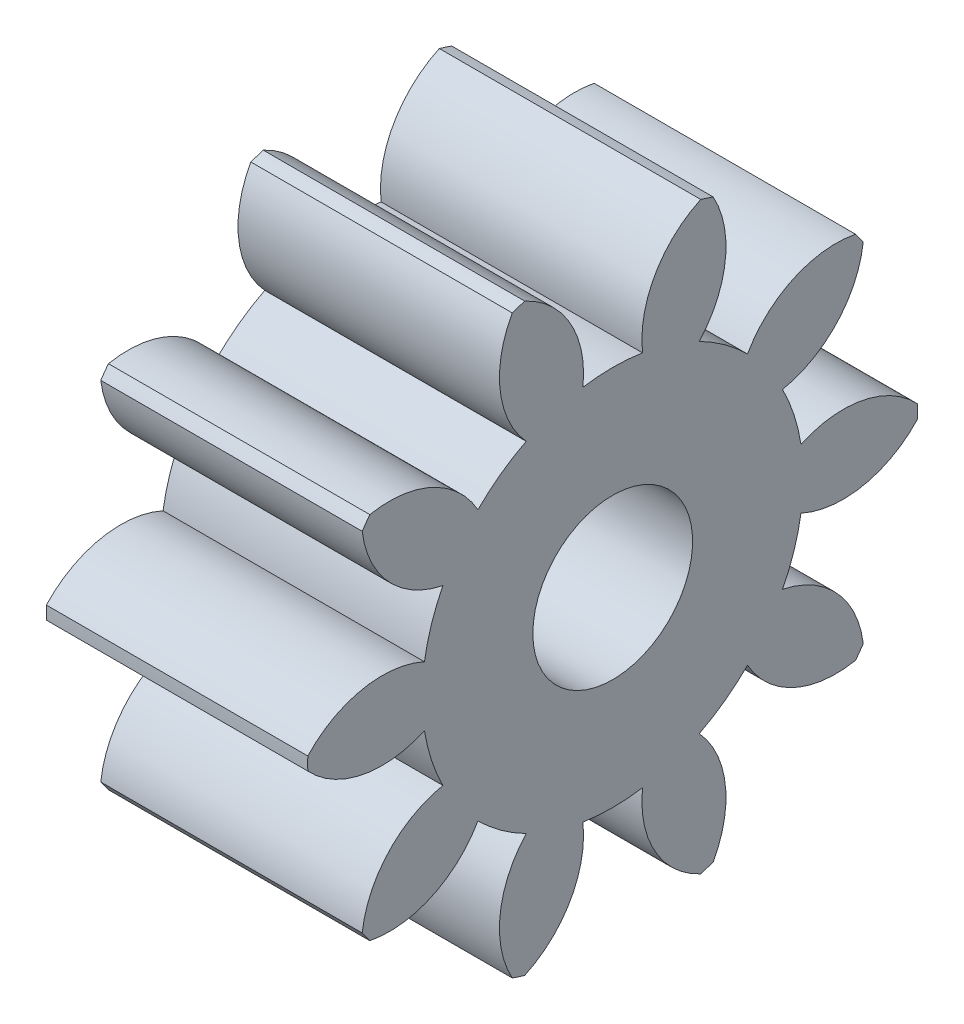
SolidWorks part; units mm, degrees
ref_plane "Plane1" through (0, 0, 0) normal (0, 0, 1) x (1, 0, 0)
ref_plane "Plane2" through (0, 0, 0) normal (0, 1, 0) x (1, 0, 0)
ref_plane "Plane3" through (0, 0, 0) normal (1, 0, 0) x (0, 0, -1)
other "Configuration Table"
sketch "HoldingSke" plane through (0, 0, 0) normal (0, 1, 0) x (1, 0, 0)
  line L0 (0, 0) -> (0.2814, -0.0496)
  line L1 (-15, 0) -> (100, 0) construction
  line L2 (0, 0) -> (-2.1039, 2.3779)
  line L3 (0, 0) -> (-11.863, 4.5341)
  line L4 (0, 0) -> (8.5048, 1.4996)
  line L5 (0, 0) -> (-46.8476, -17.4728)
  line L6 (0, 0) -> (-14.9213, -10.0675)
  line L7 (-2.1039, 2.3779) -> (8.6586, 51.2059)
  line L8 (-76.2, 54.61) -> (-74.4, 54.61)
  line L9 (-71.009, 38.7566) -> (-53.1078, 45.2721)
  line L10 (-76.2, 71.12) -> (104.1128, 71.12)
  line L11 (0, 0) -> (-18, 0)
  line L12 (-76.2, 101.6) -> (-76.083, 101.6)
  line L13 (24.9733, 27.94) -> (52.9518, 28.4284)
  line L14 (24.9733, 27.94) -> (24.9743, 27.94)
  line L15 (24.9733, 27.94) -> (100.4006, 29.5858)
  line L16 (-63.627, -3.5) -> (-12.827, -3.5)
  circle A0 centre (0, 0) radius 5.5
  circle A1 centre (0, 0) radius 13.124
  circle A2 centre (0, 0) radius 37.5
  circle A3 centre (0, 0) radius 5.5
sketch "BasProSke" plane through (0, 0, 0) normal (0, 1, 0) x (1, 0, 0)
  line L0 (-10, 0) -> (60, 0) construction
  line L1 (0, 0) -> (0, 21)
  line L2 (0, 0) -> (18, 0)
  line L3 (18, 0) -> (18, 21)
  line L4 (18, 21) -> (0, 21)
revolve "Base-Revolve" add sketch "BasProSke" angle 360 about L0
sketch "TooCutSke" plane through (0, 0, 0) normal (1, 0, 0) x (0, 0, -1)
  line L1 (0, 0) -> (0, 107) construction
  line L2 (0, 0) -> (-2.942, 17.2509) construction
  line L3 (0, 0) -> (-10.7017, 32.9365) construction
  line L4 (-2.942, 17.2509) -> (-5.3509, 16.4682) construction
  arc A0 (2.0535, 12.9624) -> (-2.0535, 12.9624) centre (0, 0) ccw
  arc A1 (6.0946, 20.1227) -> (-6.0946, 20.1227) centre (0, 0) ccw
  circle A2 centre (0, 0) radius 17.5 construction
  circle A3 centre (0, 0) radius 16.4446 construction
  arc A4 (-2.0535, 12.9624) -> (-6.0946, 20.1227) centre (-9.0081, 13.7579) ccw
  arc A5 (6.0946, 20.1227) -> (2.0535, 12.9624) centre (9.0081, 13.7579) ccw
extrude "ToothCut" cut sketch "TooCutSke" along normal through all
fillet "Breaks" [suppressed] radius 0.07
fillet "RootFillets" [suppressed] radius 0.876
pattern_circular "TeethCuts" count 10 every 36 about axis through (-10, 0, 0) along (1, 0, 0) of "ToothCut", "RootFillets", "Breaks"
sketch "HubNeaOneSke" plane through (0, 0, 0) normal (-1, 0, 0) x (0, 0, 1)
  circle A0 centre (0, 0) radius 13.124
extrude "HubNearOne" [suppressed] add sketch "HubNeaOneSke" along normal blind 32.0001
sketch "HubNeaBotSke" plane through (0, 0, 0) normal (-1, 0, 0) x (0, 0, 1)
  circle A0 centre (0, 0) radius 13.124
extrude "HubNearBoth" [suppressed] add sketch "HubNeaBotSke" along normal blind 16
ref_plane "FarPln" through (18, 0, 0) normal (1, 0, 0) x (0, 0, -1)
sketch "HubFarSke" plane through (18, 0, 0) normal (1, 0, 0) x (0, 0, -1)
  circle A0 centre (0, 0) radius 13.124
extrude "HubFar" [suppressed] add sketch "HubFarSke" along normal blind 16
sketch "BorSke" plane through (0, 0, 0) normal (1, 0, 0) x (0, 0, -1)
  circle A0 centre (0, 0) radius 5.5
extrude "Bore" cut sketch "BorSke" along normal mid plane 100.0001
sketch "KeySke" plane through (0, 0, 0) normal (1, 0, 0) x (0, 0, -1)
  line L0 (-2, 0) -> (-2, 7.3)
  line L1 (-2, 7.3) -> (2, 7.3)
  line L2 (2, 7.3) -> (2, 0)
  line L3 (0, 0) -> (0, 34) construction
  line L4 (-2, 0) -> (2, 0)
extrude "Keyway" [suppressed] cut sketch "KeySke" along normal mid plane 100.0001
pattern_circular "Keyway2" [suppressed] count 2 every 90 about axis through (-10, 0, 0) along (1, 0, 0)
equation "' \"Module@HoldingSke\" = 6.35"
equation "' \"Num_teeth@HoldingSke\" = 12"
equation "' \"Ap@HoldingSke\" =  20"
equation "' \"Ap@HoldingSke\" = 20"
equation "' \"Width@HoldingSke\" = 0.5 * 25.4"
equation "' \"Hub_dia@HoldingSke\"= 1 * 25.4"
equation "' \"Hub_dia@HoldingSke\" = 1 * 25.4"
equation "' \"Overall_len@HoldingSke\" = 1.0 * 25.4"
equation "' \"Bore@HoldingSke\" = 0.75 * 25.4"
equation "' \"T_dim@HoldingSke\" = 0.1 * 25.4"
equation "' \"Width@KeySke\" = 0.25 * 25.4"
equation "' \"Show_teeth@HoldingSke\" = 13"
equation "' \"Backlash@HoldingSke\" = 0.009 * 25.4"
equation "' \"Addendum_fac@HoldingSke\" = 1.0"
equation "' \"Dedendum_fac@HoldingSke\" = 1.25"
equation "' \"Dedendum_add@HoldingSke\" = 0.00005 * 25.4"
equation "' \"Clearance_fac@HoldingSke\" = 0.25"
equation "\"Pitch@HoldingSke\" = 1 / \"Module@HoldingSke\""
equation "\"Overcut_dia@TooCutSke\" = (\"Num_teeth@HoldingSke\" + 2 * \"Addendum_fac@HoldingSke\") / \"Pitch@HoldingSke\" + 0.002 * 25.4"
equation "\"Pitch_dia@TooCutSke\" = \"Num_teeth@HoldingSke\" / \"Pitch@HoldingSke\""
equation "\"Base_dia@TooCutSke\" = \"Num_teeth@HoldingSke\" / \"Pitch@HoldingSke\" * cos((\"Ap@HoldingSke\"  * 3.14159265 / 180))"
equation "\"Root_dia@TooCutSke\" = (\"Num_teeth@HoldingSke\" + 2) / \"Pitch@HoldingSke\" - 2 * (\"Addendum_fac@HoldingSke\" + \"Dedendum_fac@HoldingSke\") / \"Pitch@HoldingSke\" - \"Dedendum_add@HoldingSke\" * 2"
equation "\"Half_ang@TooCutSke\" = 180 / \"Num_teeth@HoldingSke\""
equation "\"Half_CT@TooCutSke\" = \"Num_teeth@HoldingSke\" / \"Pitch@HoldingSke\" * sin((3.14159265 / 2 / \"Num_teeth@HoldingSke\")) / 2 - 7 * \"Backlash@HoldingSke\" / 4"
equation "\"Flank_rad@TooCutSke\" = \"Num_teeth@HoldingSke\" / \"Pitch@HoldingSke\" / 5"
equation "\"Radius@RootFillets\" = \"Clearance_fac@HoldingSke\" / \"Pitch@HoldingSke\" + \"Dedendum_add@HoldingSke\""
equation "\"Break_rad@Breaks\" = 0.02 / \"Pitch@HoldingSke\""
equation "\"Thickness@HoldingSke\" = \"Width@HoldingSke\""
equation "\"OAL@HoldingSke\" = \"Thickness@HoldingSke\""
equation "\"MHD@HoldingSke\" = (\"Num_teeth@HoldingSke\" + 2) / \"Pitch@HoldingSke\" - 2 * (\"Addendum_fac@HoldingSke\" + \"Dedendum_fac@HoldingSke\")  / \"Pitch@HoldingSke\" - \"Dedendum_add@HoldingSke\" * 2"
equation "\"MBD@HoldingSke\" = (\"Num_teeth@HoldingSke\" + 2) / \"Pitch@HoldingSke\" - 2 * (\"Addendum_fac@HoldingSke\" + \"Dedendum_fac@HoldingSke\")  / \"Pitch@HoldingSke\" - \"Dedendum_add@HoldingSke\" * 2 - 0.002 * 25.4"
equation "\"MHD@HoldingSke\" = ((sgn( \"MHD@HoldingSke\" - \"Hub_dia@HoldingSke\" )-1)*( \"MHD@HoldingSke\" - \"Hub_dia@HoldingSke\" ))/-2+ \"Hub_dia@HoldingSke\""
equation "\"MBD@HoldingSke\" = ((sgn( \"MBD@HoldingSke\" - \"Bore@HoldingSke\" )-1)*( \"MBD@HoldingSke\" - \"Bore@HoldingSke\" ))/-2+ \"Bore@HoldingSke\""
equation "\"OAL@HoldingSke\" = ((sgn( \"OAL@HoldingSke\" - \"Overall_len@HoldingSke\" )+1)*( \"OAL@HoldingSke\" - \"Overall_len@HoldingSke\" ))/2 + \"Overall_len@HoldingSke\" + 0.000002 * 25.4"
equation "\"Num_teeth@TeethCuts\" = int( \"Show_teeth@HoldingSke\" ) + 1"
equation "\"Num_teeth@TeethCuts\" = ((sgn( \"Num_teeth@TeethCuts\" - \"Num_teeth@HoldingSke\" )-1)*( \"Num_teeth@TeethCuts\" - \"Num_teeth@HoldingSke\" ))/-2+ \"Num_teeth@HoldingSke\""
equation "\"Num_teeth@TeethCuts\" = ((sgn( \"Num_teeth@TeethCuts\" - 2.0)+1)*( \"Num_teeth@TeethCuts\" - 2.0))/2 +2.0"
equation "\"Angle@TeethCuts\" = 360.0 / \"Num_teeth@HoldingSke\""
equation "\"Diameter@BasProSke\" = (\"Num_teeth@HoldingSke\" + 2 * \"Addendum_fac@HoldingSke\") / \"Pitch@HoldingSke\""
equation "\"Thickness@BasProSke\"  = \"Thickness@HoldingSke\""
equation "' \"Fillet_rad@BasProSke\" =  \"Thickness@HoldingSke\" * 0.05"
equation "' \"Fillet_rad@BasProSke\" = \"Thickness@HoldingSke\" * 0.05"
equation "\"MHD@HoldingSke\" = ((sgn( \"MHD@HoldingSke\" - \"Root_dia@TooCutSke\" )-1)*( \"MHD@HoldingSke\" - \"Root_dia@TooCutSke\" ))/-2+ \"Root_dia@TooCutSke\""
equation "\"Diameter@HubNeaOneSke\" = \"MHD@HoldingSke\""
equation "\"Length@HubNearOne\" = \"OAL@HoldingSke\" - \"Thickness@BasProSke\""
equation "\"Diameter@HubNeaBotSke\" = \"MHD@HoldingSke\""
equation "\"Length@HubNearBoth\" = ( \"OAL@HoldingSke\" - \"Thickness@BasProSke\" ) / 2.0"
equation "\"Thickness@FarPln\" = \"Thickness@BasProSke\""
equation "\"Diameter@HubFarSke\" = \"MHD@HoldingSke\""
equation "\"Length@HubFar\" = ( \"OAL@HoldingSke\" - \"Thickness@BasProSke\" ) / 2.0"
equation "\"Diameter@BorSke\" = \"MBD@HoldingSke\""
equation "\"D1@Bore\" = \"OAL@HoldingSke\" * 2.0"
equation "\"D1@Keyway\" = \"OAL@HoldingSke\" * 2.0"
equation "\"Offset@KeySke\" = \"T_dim@HoldingSke\" + \"MBD@HoldingSke\" / 2.0"
